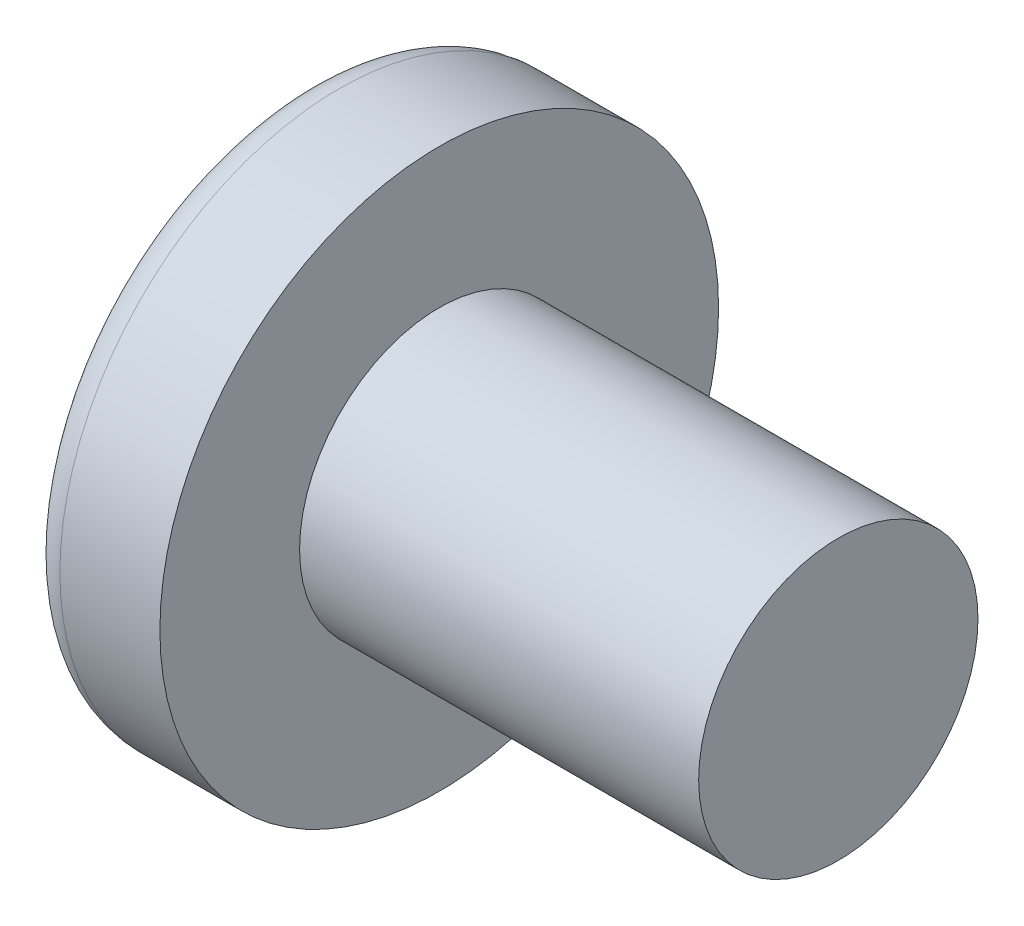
SolidWorks part; units mm, degrees
ref_plane "Plane1" through (0, 0, 0) normal (0, 0, 1) x (1, 0, 0)
ref_plane "Plane2" through (0, 0, 0) normal (0, 1, 0) x (1, 0, 0)
ref_plane "Plane3" through (0, 0, 0) normal (1, 0, 0) x (0, 0, -1)
sketch "BodySke" plane through (0, 0, 0) normal (0, 0, 1) x (1, 0, 0)
  line L0 (2.6, 1.75) -> (2.6, 3.5)
  line L1 (3.2, 6.35) -> (3.2, -3.175) construction
  line L2 (-25.4, 0) -> (127, 0) construction
  line L3 (7.6, 0) -> (0, 0)
  line L4 (2.6, 1.75) -> (7.6, 1.75)
  line L5 (7.6, 1.75) -> (7.6, 0)
  line L6 (1.347, 3.5) -> (2.6, 3.5)
  line L7 (2.6, -1.75) -> (7.6, -1.75) construction
  line L8 (2.6, 6.35) -> (2.6, -3.175) construction
  arc A0 (0.9968, 3.3118) -> (0, 0) centre (6, 0) ccw
  arc A2 (0.9968, 3.3118) -> (1.347, 3.5) centre (1.347, 3.08) cw
  dimension "Head_fillet_rad" = 0.42
  dimension "Head_crown_rad" = 6
  dimension "Head_ht" = 2.6
  dimension "Diameter" = 3.5
  dimension "Length" = 5
  dimension "Head_dia" = 7
  dimension "Advance" = 0.6
  dimension "Thread_nom" = 5
revolve "Base-Revolve" add sketch "BodySke" angle 360 about L2
sketch "Sketch3" plane through (0, 0, 0) normal (1, 0, 0) x (0, 0, -1)
  line L0 (0.435, -1.96) -> (-0.435, -1.96)
  line L1 (0.435, -1.96) -> (0.435, 1.96)
  line L2 (-0.435, 1.96) -> (0.435, 1.96)
  line L3 (-0.435, 1.96) -> (-0.435, -1.96)
  dimension "D1" = 1.96
  dimension "Cross_dia" = 3.92
  dimension "D2" = 0.435
  dimension "Cross_width" = 0.87
ref_plane "Plane4" through (1.95, 0, 0) normal (1, 0, 0) x (0, 0, -1)
sketch "Sketch4" plane through (1.95, 0, 0) normal (1, 0, 0) x (0, 0, -1)
  line L0 (0.2175, -0.2175) -> (-0.2175, -0.2175)
  line L1 (0.2175, -0.2175) -> (0.2175, 0.2175)
  line L2 (-0.2175, 0.2175) -> (0.2175, 0.2175)
  line L3 (-0.2175, 0.2175) -> (-0.2175, -0.2175)
  dimension "D1" = 0.435
  dimension "D2" = 0.435
  dimension "D3" = 0.2175
  dimension "D4" = 0.2175
loft "Cut-Loft1" cut profiles "Sketch3", "Sketch4"
pattern_circular "CirPattern1" count 2 every 90 about axis through (0, 0, 0) along (1, 0, 0) of "Cut-Loft1"
sketch "ThdSchSke" plane through (0, 0, 0) normal (0, 0, 1) x (1, 0, 0)
  line L0 (3.2, -1.4145) -> (2.9651, -1.75)
  line L1 (3.2, -1.4145) -> (3.4349, -1.75)
  line L2 (3.4349, -1.75) -> (3.4349, -2.1875)
  line L3 (-3.175, 0) -> (5.1513, 0) construction
  line L5 (3.4349, -2.1875) -> (2.9651, -2.1875)
  line L6 (2.9651, -2.1875) -> (2.9651, -1.75)
  dimension "Thread_minor" = 2.829
  dimension "Diameter" = 3.5
  dimension "Start" = 3.2
  dimension "SideAngle" = 55
  dimension "VeeAngle" = 70
  dimension "Overcut" = 4.375
revolve "ThreadSchematic" [suppressed] cut sketch "ThdSchSke" angle 360 about L3
pattern_linear "ThdSchPat" [suppressed]
equation "\"D1@Sketch3\" = \"Cross_dia@Sketch3\" / 2"
equation "\"D2@Sketch3\" = \"Cross_width@Sketch3\" / 2"
equation "\"D1@Sketch4\" = \"Cross_width@Sketch3\" *.5"
equation "\"D2@Sketch4\" = \"D1@Sketch4\""
equation "\"D3@Sketch4\" = \"D1@Sketch4\" / 2"
equation "\"D4@Sketch4\" = \"D2@Sketch4\" / 2"
equation "\"Thread_length@ThreadCosmetic\" = ((sgn( (\"Length@BodySke\" - \"Advance@BodySke\" ) - \"Thread_nom@BodySke\" )-1)*( (\"Length@BodySke\" - \"Advance@BodySke\" ) - \"Thread_nom@BodySke\" ))/-2+ \"Thread_nom@BodySke\""
equation "\"Thread_minor@ThdSchSke\" = \"Thread_minor@ThreadCosmetic\""
equation "\"Diameter@ThdSchSke\" = \"Diameter@BodySke\""
equation "\"Overcut@ThdSchSke\" = \"Diameter@BodySke\" * 1.25"
equation "\"Start@ThdSchSke\" = \"Head_ht@BodySke\" + \"Length@BodySke\" - \"Thread_length@ThreadCosmetic\"  '---Non-countersunk---"
equation "\"Num_threads@ThdSchPat\" = int( \"Thread_length@ThreadCosmetic\" / \"Advance@BodySke\" + 0.999 )  + 1"
equation "\"Advance@ThdSchPat\" = \"Thread_length@ThreadCosmetic\" /  (\"Num_threads@ThdSchPat\" - 1) 'relax it"
